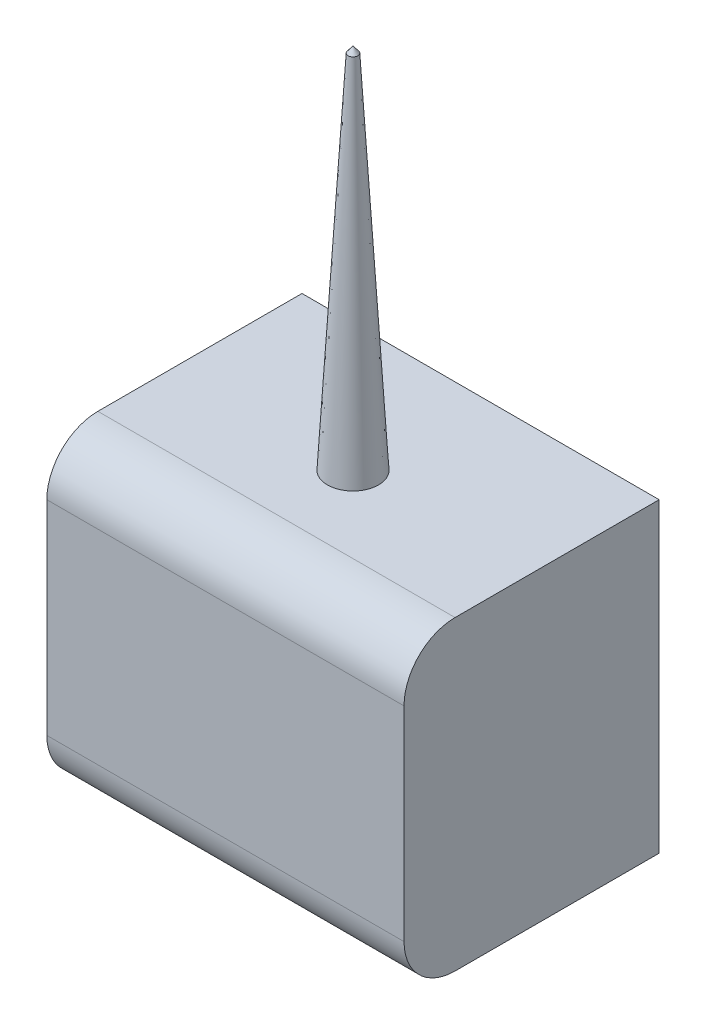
SolidWorks part; units mm, degrees
ref_plane "Plan de face" through (0, 0, 0) normal (0, 0, 1) x (1, 0, 0)
ref_plane "Plan de dessus" through (0, 0, 0) normal (0, 1, 0) x (1, 0, 0)
ref_plane "Plan de droite" through (0, 0, 0) normal (1, 0, 0) x (0, 0, -1)
sketch "Esquisse1" plane through (0, 0, 0) normal (0, 0, 1) x (1, 0, 0)
  line L1 (0, 0) -> (70, 0)
  line L2 (0, 0) -> (0, 60)
  line L3 (0, 60) -> (70, 60)
  line L4 (70, 0) -> (70, 60)
  dimension "D1" = 60
  dimension "D2" = 70
extrude "Extrusion1" add sketch "Esquisse1" along normal blind 50
fillet "Congé1" radius 10 2 edges at (35, 0, 50) (35, 60, 50)
ref_plane "Plan1" through (0, 0, 25) normal (0, 0, 1) x (1, 0, 0)
sketch "Esquisse3" plane through (0, 0, 25) normal (0, 0, 1) x (1, 0, 0)
  line L0 (35, 28.0596) -> (35, 132) construction
  line L1 (35, 132) -> (34.0571, 130.8151)
  line L2 (0, 50) -> (0, 10) construction
  line L3 (30, 60) -> (35, 60)
  line L4 (35, 60) -> (35, 132)
  line L5 (70, 60) -> (0, 60) construction
  line L6 (34.0571, 130.8151) -> (30, 60)
  dimension "D1" = 72
  dimension "D3" = 35
  dimension "D4" = 5
revolve "Révolution1" add sketch "Esquisse3" angle 360 about L0
sketch "Esquisse4" plane through (0, 0, 0) normal (0, 0, -1) x (-1, 0, 0)
  line L0 (-70, 0) -> (-70, 60) construction
  line L1 (-70, 60) -> (0, 60) construction
  circle A0 centre (-35, 53) radius 2.5
  dimension "D1" = 5
  dimension "D2" = 35
  dimension "D3" = 7
extrude "Extrusion2" cut sketch "Esquisse4" against normal blind 2
sketch "Esquisse5" plane through (0, 0, 0) normal (0, 0, -1) x (-1, 0, 0)
  line L0 (0, 0) -> (-70, 0) construction
  line L1 (-40, 0) -> (-30, 0)
  line L2 (-40, 0) -> (-40, -10)
  line L3 (-40, -10) -> (-30, -10)
  line L4 (-30, 0) -> (-30, -10)
  line L5 (0, 60) -> (0, 0) construction
  circle A0 centre (-35, -6.5) radius 2.5
  dimension "D1" = 6.5
  dimension "D2" = 5
  dimension "D5" = 30
  dimension "D6" = 35
  dimension "D3" = 10
  dimension "D4" = 10
extrude "Extrusion3" add sketch "Esquisse5" against normal blind 2
